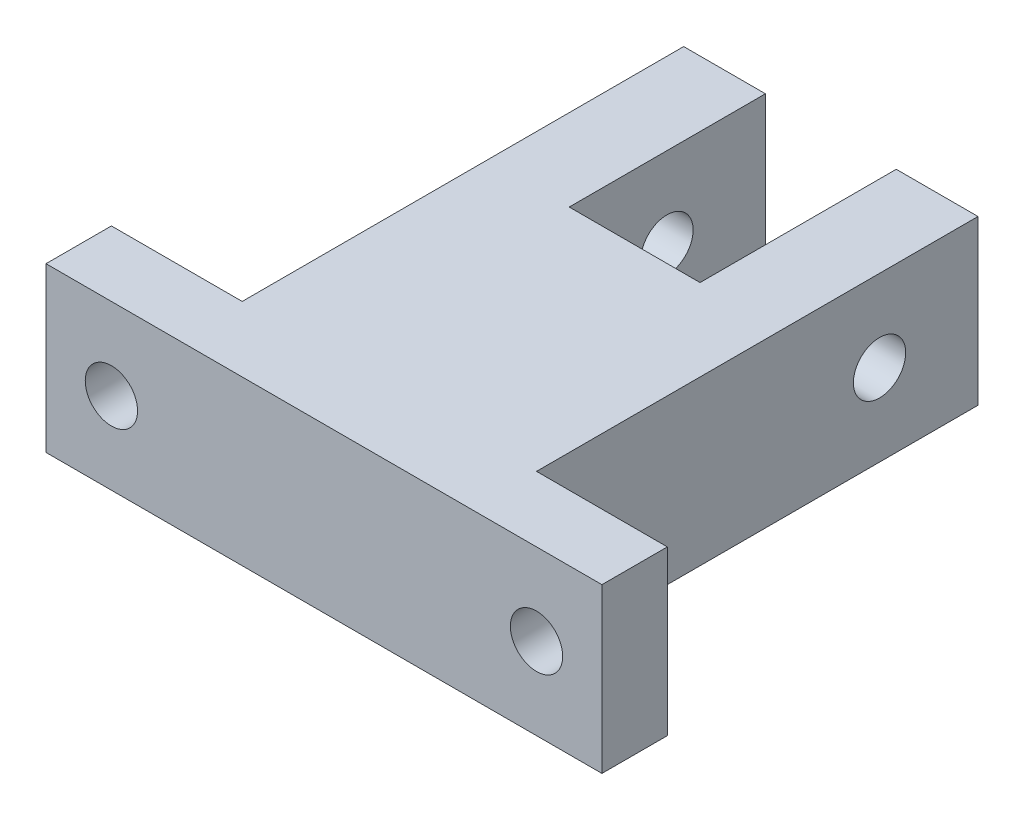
SolidWorks part; units mm, degrees
ref_plane "Front Plane" through (0, 0, 0) normal (0, 0, 1) x (1, 0, 0)
ref_plane "Top Plane" through (0, 0, 0) normal (0, 1, 0) x (1, 0, 0)
ref_plane "Right Plane" through (0, 0, 0) normal (1, 0, 0) x (0, 0, -1)
sketch "Sketch2" plane through (0, 0, 0) normal (0, 1, 0) x (1, 0, 0)
  line L0 (-17, 0) -> (17, 0)
  line L1 (17, 0) -> (17, 4)
  line L2 (17, 4) -> (9, 4)
  line L3 (9, 4) -> (9, 31)
  line L4 (9, 31) -> (4, 31)
  line L5 (4, 31) -> (4, 19)
  line L6 (4, 19) -> (-4, 19)
  line L7 (-4, 19) -> (-4, 31)
  line L8 (-4, 31) -> (-9, 31)
  line L9 (-9, 31) -> (-9, 4)
  line L10 (-9, 4) -> (-17, 4)
  line L11 (-17, 4) -> (-17, 0)
  point P4 (0, 0)
extrude "Boss-Extrude1" add sketch "Sketch2" along normal blind 10
sketch "Sketch3" plane through (0, 0, 0) normal (0, 0, 1) x (1, 0, 0)
  line L6 (0, 0) -> (0, 10) construction
  line L7 (4, 10) -> (-4, 10) construction
  circle A0 centre (13, 5) radius 1.6
  circle A1 centre (-13, 5) radius 1.6
extrude "Cut-Extrude1" cut sketch "Sketch3" along normal blind 1 and the other way blind 6
sketch "Sketch4" plane through (0, 0, 0) normal (1, 0, 0) x (0, 0, -1)
  circle A0 centre (24.9781, 5) radius 1.6
extrude "Cut-Extrude2" cut sketch "Sketch4" against normal blind 9 and the other way blind 9
